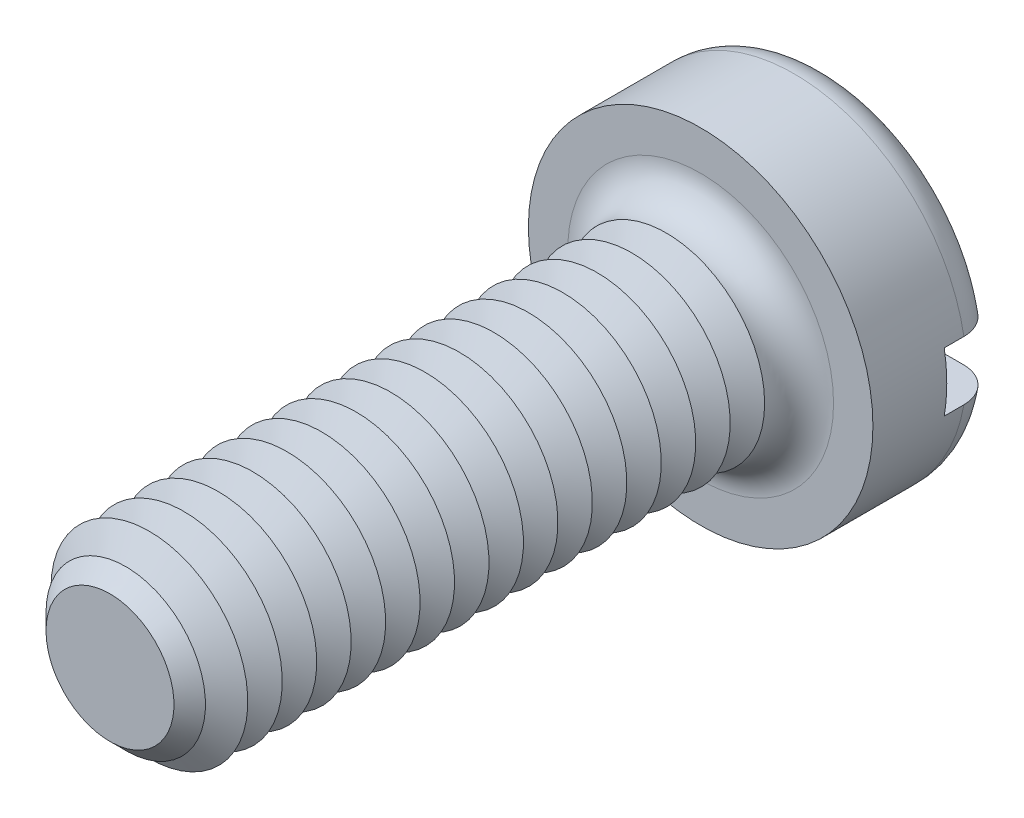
SolidWorks part; units mm, degrees
ref_plane "Front Plane" through (0, 0, 0) normal (0, 0, 1) x (1, 0, 0)
ref_plane "Top Plane" through (0, 0, 0) normal (0, 1, 0) x (1, 0, 0)
ref_plane "Right Plane" through (0, 0, 0) normal (1, 0, 0) x (0, 0, -1)
sketch "Sketch3" plane through (0, 0, 0) normal (0, 0, 1) x (1, 0, 0)
  circle A0 centre (0, 0) radius 3.5
  dimension "D1" = 7
extrude "Boss-Extrude2" add sketch "Sketch3" against normal blind 2.6
sketch "Sketch4" plane through (0, 0, 0) normal (0, 0, 1) x (1, 0, 0)
  circle A0 centre (0, 0) radius 2
  dimension "D1" = 4
extrude "Boss-Extrude3" add sketch "Sketch4" along normal blind 12
fillet "Fillet1" radius 0.7 2 edges at (3.5, 0, -2.6) (2, 0, 0)
chamfer "Chamfer1" distance 0.7 angle 45 1 edges at (2, 0, 12)
sketch "Sketch5" plane through (0, 0, 0) normal (1, 0, 0) x (0, 0, -1)
  line L0 (1.6944, 0) -> (-7.6738, 0) construction
sketch "Sketch6" plane through (0, 0, 0) normal (1, 0, 0) x (0, 0, -1)
  line L0 (-0.7, 2) -> (-1.05, 1.3938)
  line L1 (-1.05, 1.3938) -> (-1.4, 2)
  line L2 (-0.7, 2) -> (-11.3, 2) construction
  line L3 (-1.4, 2) -> (-0.7, 2)
  dimension "D1" = 0.7
revolve "Cut-Revolve1" cut sketch "Sketch6" angle 360 about L0
pattern_linear "LPattern1" count 16 spacing 0.7 along (0, 0, 1) of "Cut-Revolve1"
sketch "Sketch8" plane through (0, 0, -2.6) normal (0, 0, -1) x (-1, 0, 0)
  line L1 (3.5, -0.6) -> (-3.5, -0.6)
  line L2 (3.5, -0.6) -> (3.5, 0.6)
  line L3 (3.5, 0.6) -> (-3.5, 0.6)
  line L4 (-3.5, -0.6) -> (-3.5, 0.6)
  line L5 (3.5, -0.6) -> (-3.5, 0.6) construction
  line L6 (3.5, 0.6) -> (-3.5, -0.6) construction
  point P0 (0, 0)
  dimension "D1" = 7
  dimension "D2" = 1.2
extrude "Cut-Extrude1" cut sketch "Sketch8" against normal blind 1.1
